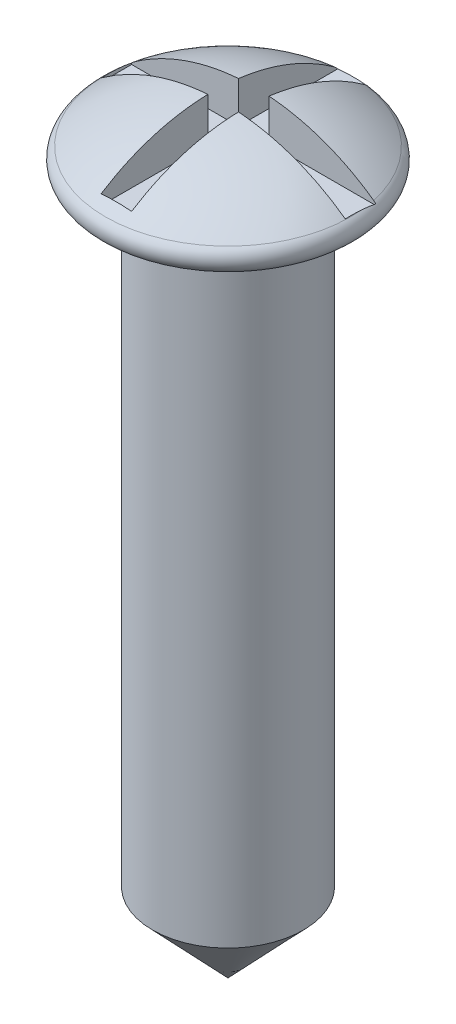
SolidWorks part; units mm, degrees
ref_plane "Plan de face" through (0, 0, 0) normal (0, 0, 1) x (1, 0, 0)
ref_plane "Plan de dessus" through (0, 0, 0) normal (0, 1, 0) x (1, 0, 0)
ref_plane "Plan de droite" through (0, 0, 0) normal (1, 0, 0) x (0, 0, -1)
sketch "Esquisse1" plane through (0, 0, 0) normal (0, 0, 1) x (1, 0, 0)
  line L0 (0, 3.8001) -> (0, -5.0777) construction
  line L1 (1.1, 0) -> (0.55, 0)
  line L2 (0.55, 0) -> (0.55, -4.5)
  line L3 (0.55, -4.5) -> (0, -5.0777)
  line L4 (0, -5.0777) -> (0, 0.4735)
  arc A0 (1.1, 0) -> (0, 0.4735) centre (0, -1.0408) ccw
  dimension "D1" = 0.55
  dimension "D2" = 4.5
  dimension "D3" = 1.1
revolve "Révolution1" add sketch "Esquisse1" angle 360 about L0
fillet "Congé1" radius 0.1 1 edges at (0, 0, 1.1)
ref_plane "Plan1" through (0, 1.1565, 0) normal (0, 1, 0) x (-1, 0, 0)
sketch "Esquisse2" plane through (0, 1.1565, 0) normal (0, 1, 0) x (-1, 0, 0)
  line L0 (0, 0.8149) -> (0, -0.0764) construction
  line L1 (-0.1114, 0.8149) -> (0.1114, 0.8149)
  line L2 (-0.1114, 0.8149) -> (-0.1114, 0.035)
  line L3 (-0.1114, -0.9676) -> (0.1114, -0.9676)
  line L4 (0.1114, 0.8149) -> (0.1114, 0.035)
  line L5 (-0.8912, 0.035) -> (-0.1114, 0.035)
  line L6 (-0.8912, 0.035) -> (-0.8912, -0.1878)
  line L7 (-0.8912, -0.1878) -> (-0.1114, -0.1878)
  line L8 (0.8912, 0.035) -> (0.8912, -0.1878)
  line L9 (0, -0.0764) -> (0, -0.9676) construction
  line L10 (0.8912, -0.0764) -> (0, -0.0764) construction
  line L11 (0, -0.0764) -> (-0.8912, -0.0764) construction
  line L12 (0.1114, -0.1878) -> (0.8912, -0.1878)
  line L13 (-0.1114, -0.1878) -> (-0.1114, -0.9676)
  line L14 (0.1114, 0.035) -> (0.8912, 0.035)
  line L15 (0.1114, -0.1878) -> (0.1114, -0.9676)
extrude "Enlèv. mat.-Extru.1" cut sketch "Esquisse2" against normal mid plane 2
